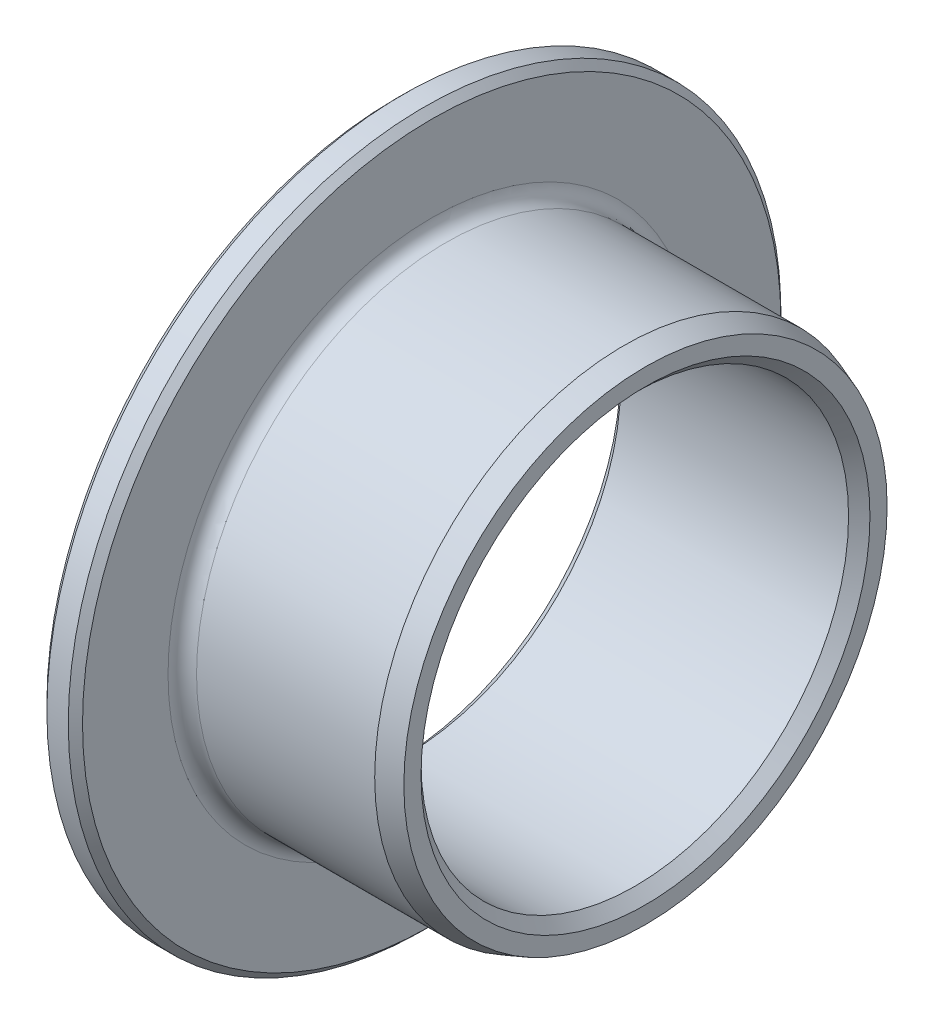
SolidWorks part; units mm, degrees
ref_plane "Face" through (0, 0, 0) normal (0, 0, 1) x (1, 0, 0)
ref_plane "Dessus" through (0, 0, 0) normal (0, 1, 0) x (1, 0, 0)
ref_plane "Droite" through (0, 0, 0) normal (1, 0, 0) x (0, 0, -1)
sketch "Esquisse1" plane through (0, 0, 0) normal (0, 0, 1) x (1, 0, 0)
  line L0 (-1, 6) -> (-1, 10)
  line L1 (-1, 10) -> (0, 10)
  line L2 (0, 10) -> (0, 7)
  line L3 (0, 7) -> (6, 7)
  line L4 (6, 7) -> (6, 6)
  line L5 (6, 6) -> (-1, 6)
  line L6 (-5.3127, 0) -> (18.9323, 0) construction
  dimension "D1" = 10
  dimension "D2" = 6
  dimension "D3" = 1
  dimension "D4" = 7
  dimension "D5" = 7
revolve "Base-Révolution" add sketch "Esquisse1" angle 360 about L6
chamfer "Chanfrein2" distance 0.6 angle 20 1 edges at (6, 0, 7)
chamfer "Chanfrein3" distance 0.3 angle 45 2 edges at (-1, 0, 6) (6, 0, 6)
chamfer "Chanfrein4" distance 0.2 angle 45 2 edges at (0, 0, 10) (-1, 0, 10)
fillet "Congé1" radius 0.4 1 edges at (0, 0, 7)
sketch "Esq_WRNL_Compact001" plane through (0, 0, 0) normal (0, 0, 1) x (1, 0, 0)
  line L0 (-2, -11) -> (-2, 11)
  line L1 (7, -11) -> (7, 11)
  line L2 (-2, -11) -> (7, -11)
  line L3 (-2, 11) -> (7, 11)
